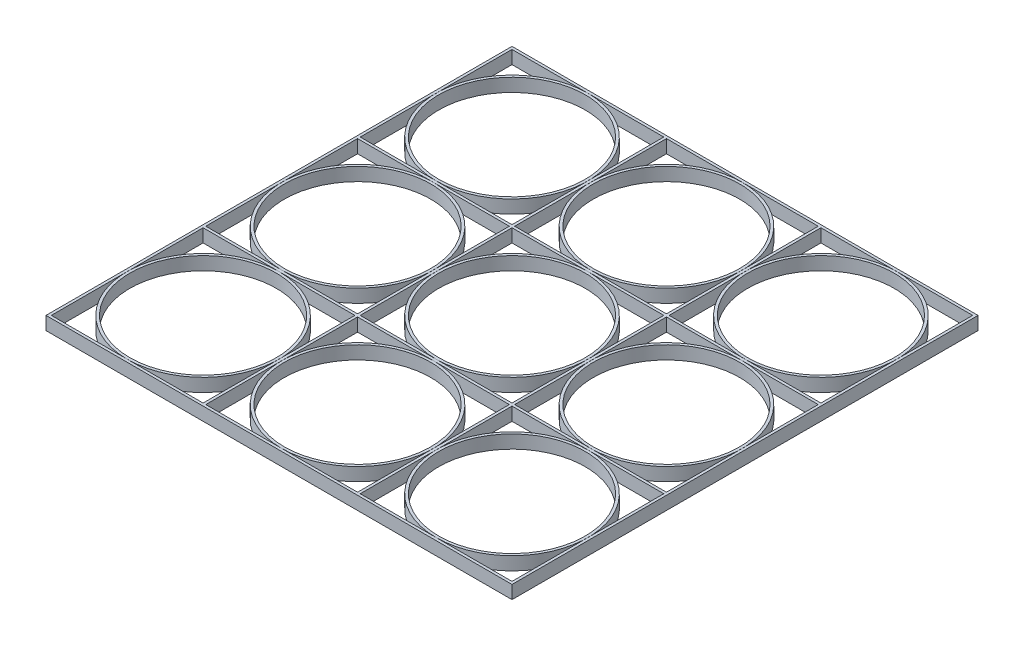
SolidWorks part; units mm, degrees
ref_plane "Front Plane" through (0, 0, 0) normal (0, 0, 1) x (1, 0, 0)
ref_plane "Top Plane" through (0, 0, 0) normal (0, 1, 0) x (1, 0, 0)
ref_plane "Right Plane" through (0, 0, 0) normal (1, 0, 0) x (0, 0, -1)
sketch "Sketch1" plane through (0, 0, 0) normal (0, 1, 0) x (1, 0, 0)
  line L1 (-29.25, 29.25) -> (29.25, 29.25)
  line L2 (-29.25, 29.25) -> (-29.25, -29.25)
  line L3 (-29.25, -29.25) -> (29.25, -29.25)
  line L4 (29.25, 29.25) -> (29.25, -29.25)
  line L5 (-29.25, 29.25) -> (29.25, -29.25) construction
  line L6 (-29.25, -29.25) -> (29.25, 29.25) construction
  line L7 (-28.75, 28.75) -> (28.75, 28.75)
  line L8 (-28.75, 28.75) -> (-28.75, -28.75)
  line L9 (-28.75, -28.75) -> (28.75, -28.75)
  line L10 (28.75, 28.75) -> (28.75, -28.75)
  line L11 (-28.75, 28.75) -> (28.75, -28.75) construction
  line L12 (-28.75, -28.75) -> (28.75, 28.75) construction
  point P0 (0, 0)
  point P6 (0, 0)
  dimension "D1" = 58.5
  dimension "D2" = 0.5
extrude "Boss-Extrude1" add sketch "Sketch1" along normal blind 5
sketch "Sketch2" plane through (0, 0, 0) normal (0, 1, 0) x (1, 0, 0)
  line L0 (-28.75, 28.75) -> (-28.75, -28.75) construction
  circle A0 centre (0, 0) radius 28.75
  circle A1 centre (0, 0) radius 27.75
  dimension "D1" = 1
extrude "Boss-Extrude2" add sketch "Sketch2" along normal blind 5 separate body
pattern_linear "LPattern2" count 3 spacing 58.5 along (1, 0, 0)
pattern_linear "LPattern3" count 3 spacing 58.5 along (0, 0, 1)
sketch "Sketch3" plane through (0, 0, 0) normal (0, 1, 0) x (1, 0, 0)
  line L1 (-29.25, 29.25) -> (146.25, 29.25)
  line L2 (-29.25, 29.25) -> (-29.25, -146.25)
  line L3 (-29.25, -146.25) -> (146.25, -146.25)
  line L4 (146.25, 29.25) -> (146.25, -146.25)
  line L5 (29.25, -146.25) -> (87.75, -146.25) construction
  dimension "D1" = 175.5
extrude "Extrude-Thin1" add sketch "Sketch3" along normal blind 5 thin
